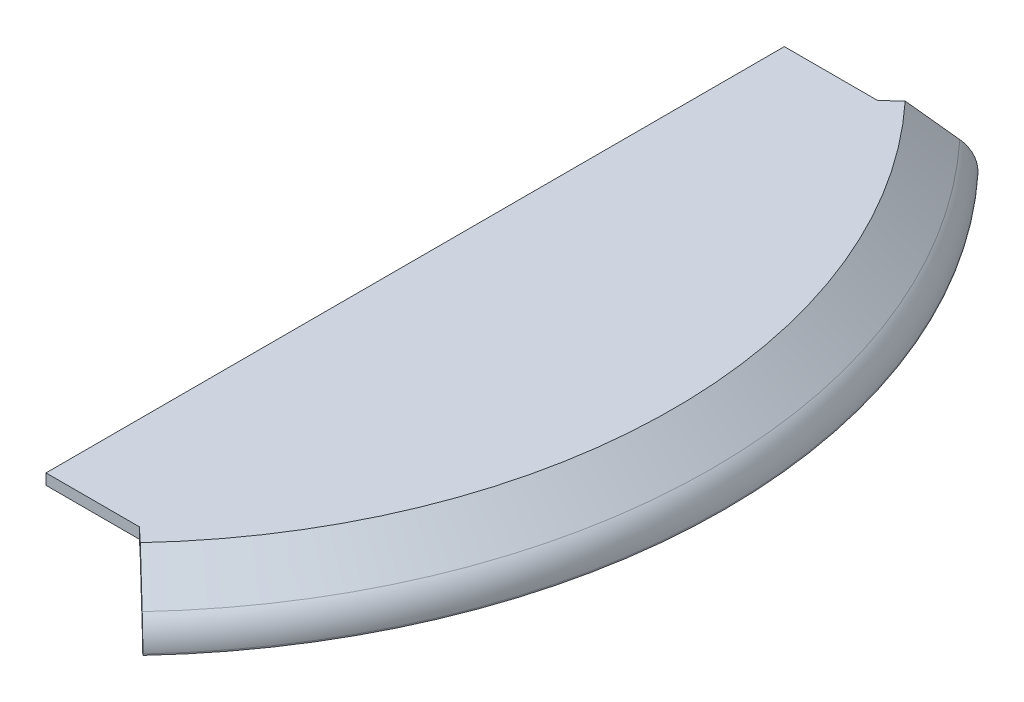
SolidWorks part; units mm, degrees
ref_plane "Plan de face" through (0, 0, 0) normal (0, 0, 1) x (1, 0, 0)
ref_plane "Plan de dessus" through (0, 0, 0) normal (0, 1, 0) x (1, 0, 0)
ref_plane "Plan de droite" through (0, 0, 0) normal (1, 0, 0) x (0, 0, -1)
sketch "Esquisse1" plane through (0, 0, 0) normal (0, 0, 1) x (1, 0, 0)
  line L0 (0, -23.4119) -> (0, 47.3219) construction
  line L1 (-353.1513, 0) -> (56.5372, 0) construction
  line L2 (-170, 0) -> (-168, 0)
  line L3 (-170, 0) -> (-170, 0.3369)
  line L4 (-166.4279, 7.9974) -> (-155.699, 17)
  line L5 (-155.699, 17) -> (0, 17)
  line L6 (0, 17) -> (0, 14)
  line L7 (0, 14) -> (-154.607, 14)
  line L8 (-154.607, 14) -> (-167.1205, 3.5)
  line L9 (-168, 3.5) -> (-168, 0)
  line L10 (-167.1205, 3.5) -> (-168, 3.5)
  arc A0 (-166.4279, 7.9974) -> (-170, 0.3369) centre (-160, 0.3369) ccw
  point P16 (-170, 5)
  dimension "D8" = 10
  dimension "D1" = 170
  dimension "D2" = 50
  dimension "D3" = 5
  dimension "D4" = 2
  dimension "D5" = 3
  dimension "D6" = 3
  dimension "D7" = 17
  dimension "D9" = 3.5
revolve "Révolution1" add sketch "Esquisse1" angle 360 about L0
sketch "Esquisse2" plane through (-94.8762, 17, -23.6399) normal (0, 1, 0) x (-1, 0, 0)
  line L0 (-51.7963, 23.6399) -> (-264.8762, 23.6399) construction
  line L1 (-170, -110.6823) -> (-170, 113.3333) construction
  line L2 (-178.8762, 126.1399) -> (-178.8762, -78.8601)
  line L3 (-94.8762, 23.6399) -> (-204.794, -78.8601) construction
  line L4 (-178.8762, -78.8601) -> (-204.794, -78.8601)
  line L5 (-204.794, -78.8601) -> (-219.2063, -92.2998)
  line L6 (-94.8762, 23.6399) -> (-204.794, 126.1399) construction
  line L7 (-204.794, 126.1399) -> (-219.2063, 139.5797)
  line L8 (-178.8762, 126.1399) -> (-204.794, 126.1399)
  arc A2 (-219.2063, 139.5797) -> (-219.2063, -92.2998) centre (-94.8762, 23.6399) ccw
  point P14 (-178.8762, 23.6399)
  dimension "D3" = 43
  dimension "D5" = 170
  dimension "D1" = 86
  dimension "D2" = 102.5
  dimension "D4" = 25.9178
extrude "Enlèv. mat.-Extru.1" cut sketch "Esquisse2" against normal through all flip side to cut
